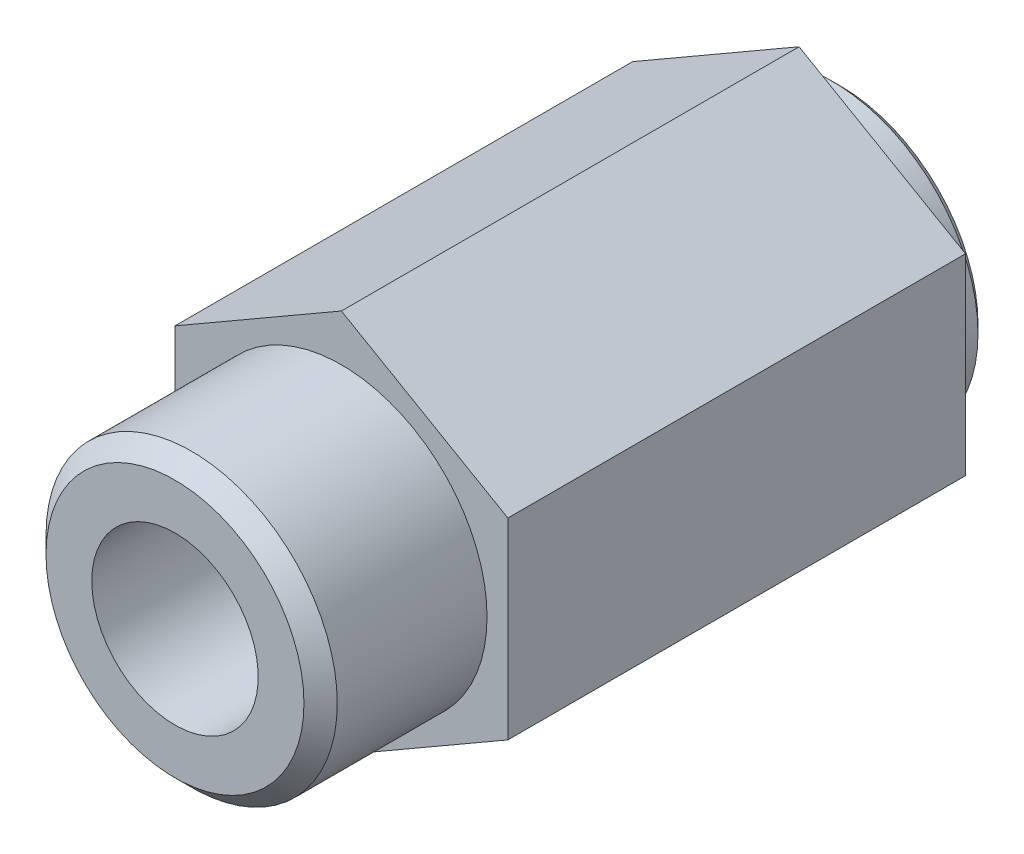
SolidWorks part; units mm, degrees
ref_plane "前视基准面" through (0, 0, 0) normal (0, 0, 1) x (1, 0, 0)
ref_plane "上视基准面" through (0, 0, 0) normal (0, 1, 0) x (1, 0, 0)
ref_plane "右视基准面" through (0, 0, 0) normal (1, 0, 0) x (0, 0, -1)
sketch "草图1" plane through (0, 0, 0) normal (0, 0, 1) x (1, 0, 0)
  line L1 (0, 23.094) -> (-20, 11.547)
  line L2 (-20, 11.547) -> (-20, -11.547)
  line L3 (-20, -11.547) -> (0, -23.094)
  line L4 (0, -23.094) -> (20, -11.547)
  line L5 (20, -11.547) -> (20, 11.547)
  line L6 (20, 11.547) -> (0, 23.094)
  circle A0 centre (0, 0) radius 20 construction
extrude "凸台-拉伸1" add sketch "草图1" along normal blind 55
sketch "草图2" plane through (0, 0, 55) normal (0, 0, 1) x (1, 0, 0)
  circle A0 centre (0, 0) radius 17.5
extrude "凸台-拉伸2" add sketch "草图2" along normal blind 20
sketch "草图3" plane through (0, 0, 0) normal (0, 0, -1) x (-1, 0, 0)
  circle A0 centre (0, 0) radius 17.5
extrude "凸台-拉伸3" add sketch "草图3" along normal blind 5
sketch "草图4" plane through (0, 0, -5) normal (0, 0, -1) x (-1, 0, 0)
  circle A0 centre (0, 0) radius 10
extrude "切除-拉伸2" cut sketch "草图4" against normal blind 80
chamfer "倒角1" distance 2 angle 45 1 edges at (17.5, 0, 75)
chamfer "倒角2" distance 1 angle 45 1 edges at (-17.5, 0, -5)
